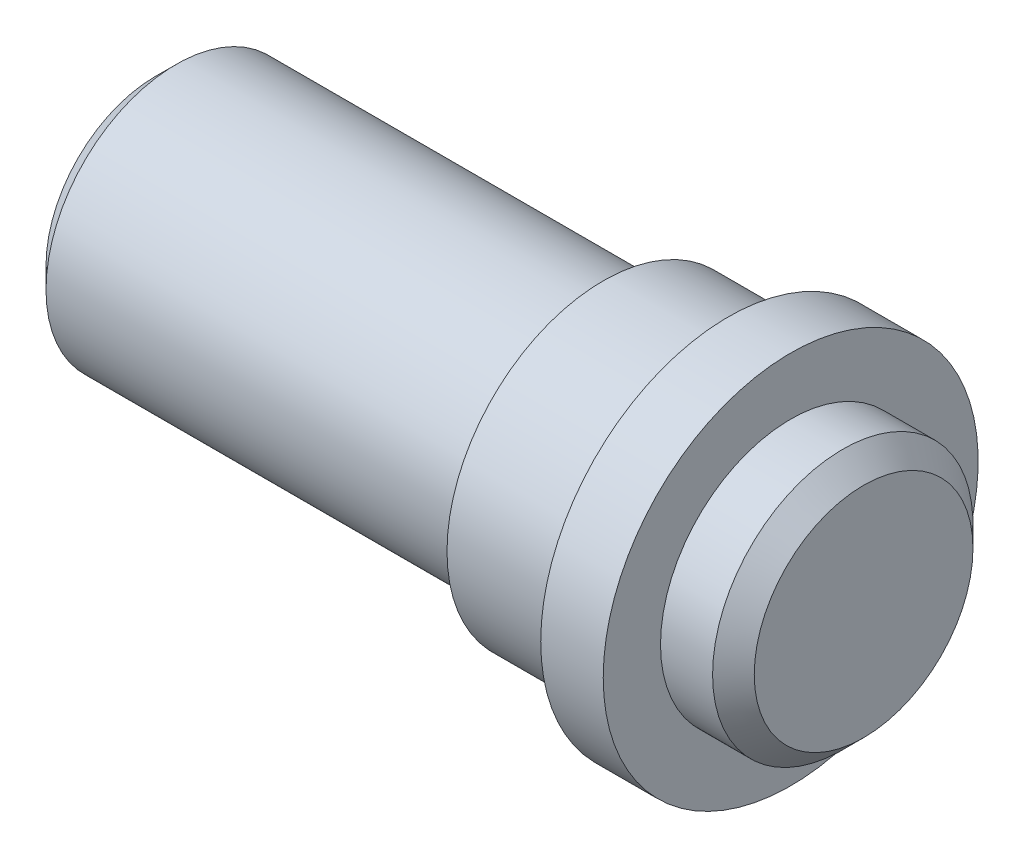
SolidWorks part; units mm, degrees
ref_plane "Plan de face" through (0, 0, 0) normal (0, 0, 1) x (1, 0, 0)
ref_plane "Plan de dessus" through (0, 0, 0) normal (0, 1, 0) x (1, 0, 0)
ref_plane "Plan de droite" through (0, 0, 0) normal (1, 0, 0) x (0, 0, -1)
sketch "Esquisse1" plane through (0, 0, 0) normal (0, 0, 1) x (1, 0, 0)
  line L0 (0, 0) -> (74.6705, 0) construction
  line L1 (0, 0) -> (0, 12.5)
  line L3 (0, 12.5) -> (43, 12.5)
  line L4 (43, 12.5) -> (43, 15)
  line L5 (43, 15) -> (55, 15)
  line L6 (55, 15) -> (55, 18)
  line L7 (55, 18) -> (61, 18)
  line L8 (61, 18) -> (61, 12.5)
  line L9 (61, 12.5) -> (68, 12.5)
  line L11 (68, 12.5) -> (68, 0)
  line L12 (68, 0) -> (0, 0)
  dimension "D1" = 12.5
  dimension "D2" = 12.5
  dimension "D3" = 68
  dimension "D4" = 7
  dimension "D5" = 6
  dimension "D6" = 12
  dimension "D7" = 15
  dimension "D8" = 18
revolve "Révolution1" add sketch "Esquisse1" angle 360 about L0
chamfer "Chanfrein1" distance 2 angle 45 2 edges at (68, 0, 12.5) (0, 0, 12.5)
hole_wizard "Trou taraudé M8x1.251" positions "Esquisse4" profile "Esquisse3" tap size "M8x1.25" standard "ISO"
sketch "Esquisse4" plane through (0, 0, 0) normal (-1, 0, 0) x (0, 0, 1)
  point P0 (0, 0)
sketch "Esquisse3" plane through (0, 0, 0) normal (0, 1, 0) x (0, 0, 1)
  line L0 (0, 0) -> (0, 25.7929)
  line L1 (0, 25.7929) -> (3.4, 23.75)
  line L2 (3.4, 23.75) -> (3.4, 20)
  line L3 (3.4, 20) -> (4, 20)
  line L4 (4, 20) -> (4, 0)
  line L5 (4, 0) -> (0, 0)
  line L10 (0, 25.7929) -> (-3.4, 23.75) construction
  line L11 (0, -6.35) -> (0, 107.95) construction
  dimension "Diamètre du trou pour taraudage" = 6.8
  dimension "Profondeur du trou pour taraudage" = 23.75
  dimension "Diamètre principal du filetage" = 8
  dimension "Profondeur du filetage" = 20
  dimension "Angle de pointe" = 118
